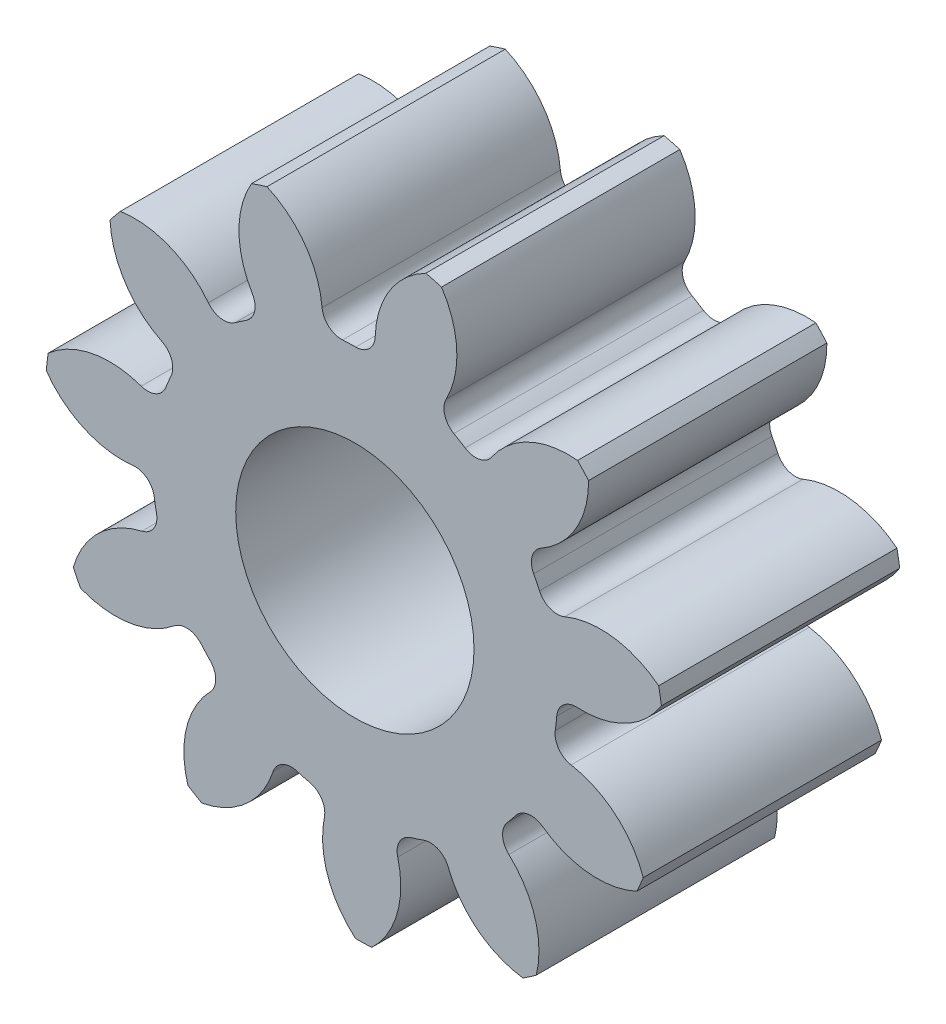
SolidWorks part; units mm, degrees
ref_plane "Front" through (0, 0, 0) normal (0, 0, 1) x (1, 0, 0)
ref_plane "Top" through (0, 0, 0) normal (0, 1, 0) x (1, 0, 0)
ref_plane "Right" through (0, 0, 0) normal (1, 0, 0) x (0, 0, -1)
sketch "Sketch3" plane through (0, 0, 0) normal (0, 0, 1) x (1, 0, 0)
  circle A0 centre (0, 0) radius 132.08
  dimension "od" = 264.16
extrude "gearBody" add sketch "Sketch3" along normal blind 101.6
sketch "Sketch2" plane through (0, 0, 0) normal (0, 0, 1) x (1, 0, 0)
  line L0 (0, 0) -> (97.0259, 40.1894) construction
  line L1 (123.7598, -50.8796) -> (0, 0) construction
  line L2 (0, 0) -> (36.3143, 0) construction
  line L3 (111.7126, 3.2537) -> (108.0561, -28.5338) construction
  line L5 (109.8844, -12.6401) -> (0, 0) construction
  line L7 (0, 0) -> (105.02, 0) construction
  arc A0 (105.0126, 1.2515) -> (101.9857, -25.0626) centre (0, 0) ccw construction
  arc A1 (130.6967, 19.0654) -> (122.9542, -48.2431) centre (0, 0) ccw construction
  arc A2 (111.7126, 3.2537) -> (108.0561, -28.5338) centre (0, 0) ccw construction
  arc A3 (85.4281, -12.6524) -> (86.0697, -7.0751) centre (0, 0) ccw
  arc A4 (123.7598, -50.8796) -> (92.1895, -22.0115) centre (85.3664, -61.1702) ccw
  arc A5 (123.7598, -50.8796) -> (132.08, 21.4501) centre (0, 0) ccw
  arc A6 (132.08, 21.4501) -> (94.7795, 0.5043) centre (97.0259, 40.1894) cw
  arc A7 (86.0697, -7.0751) -> (94.7795, 0.5043) centre (94.3121, -7.7527) cw
  arc A8 (92.1895, -22.0115) -> (85.4281, -12.6524) centre (93.6091, -13.8641) cw
  point P6 (132.08, 21.4501)
  point P22 (123.7598, -50.8796)
  dimension "baseDia" = 210.0401
  dimension "od" = 264.16
  dimension "pd" = 223.52
  dimension "rd" = 172.72
  dimension "rFillet" = 8.2702
  dimension "pointX" = 132.08
  dimension "pointY" = 21.4501
  dimension "CTT" = 31.7875
  dimension "flankCenterAngle" = 22.5
extrude "toothCut" cut sketch "Sketch2" along normal through all
pattern_circular "CirPattern1" count 11 over 360 about axis through (0, 0, 0) along (0, 0, 1) of "toothCut"
sketch "hub1Dia" plane through (0, 0, 0) normal (0, 0, -1) x (-1, 0, 0)
  circle A0 centre (0, 0) radius 12.7
  dimension "hub1Dia" = 25.4
sketch "hub2Dia" plane through (0, 0, 101.6) normal (0, 0, 1) x (1, 0, 0)
  circle A0 centre (0, 0) radius 12.7
  dimension "hub2dia" = 25.4
sketch "boreDia" plane through (0, 0, 0) normal (0, 0, 1) x (1, 0, 0)
  circle A0 centre (0, 0) radius 50.8
  dimension "boreDia" = 101.6
extrude "bore" cut sketch "boreDia" against normal mid plane 25400
